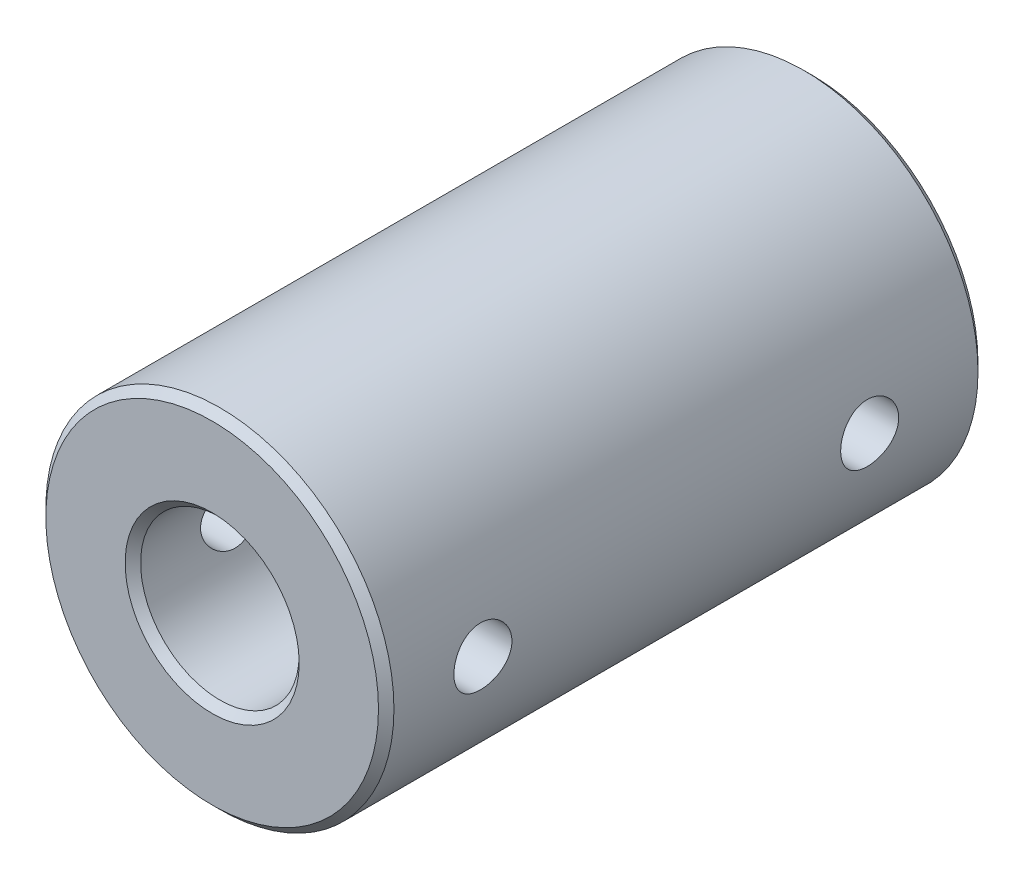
SolidWorks part; units mm, degrees
ref_plane "Front" through (0, 0, 0) normal (0, 0, 1) x (1, 0, 0)
ref_plane "Top" through (0, 0, 0) normal (0, 1, 0) x (1, 0, 0)
ref_plane "Right" through (0, 0, 0) normal (1, 0, 0) x (0, 0, -1)
sketch "Sketch1" plane through (0, 0, 0) normal (0, 0, 1) x (1, 0, 0)
  circle A0 centre (0, 0) radius 2.05
  circle A1 centre (0, 0) radius 4.5
  dimension "D1" = 4.1
  dimension "D2" = 9
extrude "Base-Extrude" add sketch "Sketch1" along normal blind 15.5
chamfer "Chamfer1" distance 0.2 angle 45 4 edges at (4.5, 0, 0) (4.5, 0, 15.5) (2.05, 0, 0) (2.05, 0, 15.5)
sketch "Sketch2" plane through (0, 0, 0) normal (1, 0, 0) x (0, 0, -1)
  line L0 (-15.3, 0) -> (-0.2, 0) construction
  line L1 (0, -4.3) -> (0, 4.3) construction
  line L3 (0, 0) -> (-17.8624, 0) construction
  circle A0 centre (-3, 0) radius 0.75
  circle A1 centre (-13, 0) radius 0.75
  dimension "D1" = 1.5
  dimension "D2" = 3
  dimension "D3" = 10
extrude "Cut-Extrude1" cut sketch "Sketch2" against normal through all and the other way through all
chamfer "Chamfer2" distance 0.2 angle 60 2 edges at (-4.4971, 0.1609, 2.2675) (-4.4971, 0.1609, 12.2675)
